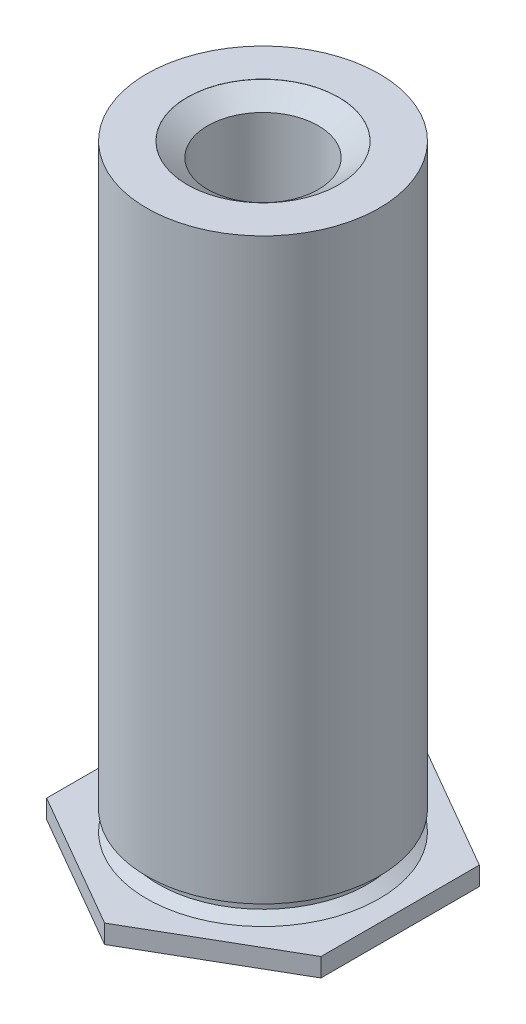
SolidWorks part; units mm, degrees
ref_plane "Plane1" through (0, 0, 0) normal (0, 0, 1) x (1, 0, 0)
ref_plane "Plane2" through (0, 0, 0) normal (0, 1, 0) x (1, 0, 0)
ref_plane "Plane3" through (0, 0, 0) normal (1, 0, 0) x (0, 0, -1)
sketch "BodySke" plane through (0, 0, 0) normal (0, 0, 1) x (1, 0, 0)
  line L0 (2.6924, 0) -> (3.683, 0)
  line L1 (3.683, 0) -> (3.683, 0.4308)
  line L2 (3.683, 0.4308) -> (2.6924, 0.4308)
  line L3 (1.2802, 14.2748) -> (1.2802, 7.4168)
  line L4 (2.6924, 0.8831) -> (2.4232, 0.8831)
  line L5 (2.4232, 0.8831) -> (2.4232, 0.5862)
  line L6 (2.6924, 0.0025) -> (2.6924, 0)
  line L7 (1.016, 13.4823) -> (3.6522, 13.4823) construction
  line L8 (2.6924, 14.2748) -> (1.2802, 14.2748)
  line L9 (0, 0) -> (0, 15.24) construction
  line L10 (2.6924, 0.0025) -> (0, 0.0025)
  line L11 (2.6924, 14.2748) -> (2.6924, 0.8831)
  line L12 (0, 7.4168) -> (1.2802, 7.4168)
  line L13 (0, 7.4168) -> (0, 0.0025)
  line L14 (1.016, 7.4168) -> (3.6522, 7.4168) construction
  line L15 (1.016, 14.2723) -> (3.6522, 14.2723) construction
  line L16 (2.6924, 0.4308) -> (2.4232, 0.5862)
  dimension "D1" = 0.0025
  dimension "E_dia" = 7.366
  dimension "D2" = 30
  dimension "C_dia" = 5.3848
  dimension "Thread_min" = 2.5603
  dimension "Clinching_ht" = 0.4308
  dimension "Advance" = 0.7925
  dimension "Length" = 14.2748
  dimension "Thread_limit" = 6.858
  dimension "Thread_depth" = 6.858
  dimension "Drill_depth" = 0.0025
  dimension "Groove_wid" = 0.4523
  dimension "Groove_dia" = 4.8463
revolve "Body" add sketch "BodySke"
revolve "EndChamfer" cut sketch "EndChamferSke" angle 360 about L0
sketch "EndChamferSke" plane through (0, 0, 0) normal (0, 0, 1) x (1, 0, 0)
  line L0 (0, -2.54) -> (0, 7.62) construction
  line L1 (0, 0) -> (0, 15.24) construction
  line L2 (1.7551, 14.2723) -> (1.7551, 14.5288)
  line L4 (1.7551, 14.2723) -> (1.7526, 14.2723)
  line L6 (1.7526, 14.2723) -> (1.2802, 13.9416)
  line L8 (1.2802, 13.9416) -> (1.2802, 14.5288)
  line L9 (1.7551, 14.5288) -> (1.2802, 14.5288)
  line L10 (2.6924, 14.2748) -> (-2.6924, 14.2748) construction
  dimension "D1" = 0.254
  dimension "Thread_nominal" = 3.5052
  dimension "D2" = 34.99
  dimension "Thread_min" = 2.5603
  dimension "Inset" = 0.0025
  dimension "B_dia" = 3.5103
revolve "TapDrill" cut sketch "TapDriSke" angle 360 about L0
sketch "TapDriSke" plane through (0, 0, 0) normal (0, 0, 1) x (1, 0, 0)
  line L0 (0, 0) -> (0, 15.24) construction
  line L1 (0, 0) -> (0, 15.24) construction
  line L2 (1.2802, 3.4544) -> (1.2802, 14.2748)
  line L3 (2.6924, 14.2748) -> (-2.6924, 14.2748) construction
  line L4 (1.2802, 3.4544) -> (0, 2.9241)
  line L5 (0, 2.9241) -> (0, 14.2748)
  line L6 (0, 14.2748) -> (1.2802, 14.2748)
  line L7 (1.2802, 7.4168) -> (1.2802, 14.2748) construction
  line L8 (0, 2.9241) -> (-1.2802, 3.4544) construction
  line L9 (-1.2802, 14.2748) -> (-1.2802, 7.4168) construction
  dimension "D1" = 135
  dimension "Depth" = 10.8204
ref_plane "Plane4" through (0, -0.5486, 0) normal (0, 1, 0) x (-1, 0, 0)
sketch "ThdSchSke" plane through (0, 0, 0) normal (0, 0, 1) x (1, 0, 0)
  line L0 (0, -5.08) -> (0, 7.62) construction
  line L1 (0, 0) -> (0, 15.24) construction
  line L2 (0, 14.2723) -> (1.7526, 14.2723) construction
  line L4 (1.7526, 14.2723) -> (1.2802, 14.6031)
  line L5 (1.7551, 14.2723) -> (-1.7551, 14.2723) construction
  line L6 (1.7526, 14.2723) -> (1.2802, 13.9415)
  line L7 (1.2802, 14.6031) -> (1.2802, 13.9415)
  dimension "Vee_angle" = 70
  dimension "Thread_nominal" = 3.5052
  dimension "Thread_min" = 2.5603
revolve "ThreadSchematic" [suppressed] cut sketch "ThdSchSke" angle 360 about L0
pattern_linear "ThdSchPat" [suppressed]
sketch "HexDieSke" plane through (0, 0.4308, 0) normal (0, 1, 0) x (-1, 0, 0)
  line L0 (0, 3.6662) -> (3.175, 1.8331)
  line L1 (3.175, 1.8331) -> (3.175, -1.8331)
  line L2 (3.175, -1.8331) -> (0, -3.6662)
  line L3 (0, -3.6662) -> (-3.175, -1.8331)
  line L4 (-3.175, -1.8331) -> (-3.175, 1.8331)
  line L5 (-3.175, 1.8331) -> (0, 3.6662)
  circle A1 centre (0, 0) radius 3.175 construction
  circle A2 centre (0, 0) radius 3.6662 construction
  circle A3 centre (0, 0) radius 3.6957
  dimension "Width_across_flats" = 6.35
  dimension "OD" = 7.3914
extrude "HexDie" cut sketch "HexDieSke" against normal blind 0.4308
equation "' \"Length@BodySke\" = 0.562"
equation "' \"C_dia@BodySke\" = 0.212"
equation "' \"Thread_depth@BodySke\" = 0.27 'always explicit"
equation "' \"Drill_depth@BodySke\" = 0.0001 'implicit, or explicit"
equation "' \"Width_across_flats@HexDieSke\" = 0.25"
equation "' \"Advance@BodySke\" = 0.0312"
equation "' \"Thread_min@BodySke\" = 0.1008"
equation "' \"Thread_nominal@ThreadCosmetic\" = 0.138"
equation "\"B_dia@EndChamferSke\" = \"Thread_nominal@ThreadCosmetic\" + 0.0002"
equation "\"E_dia@BodySke\" = \"Width_across_flats@HexDieSke\" * 1.16"
equation "\"Clinching_ht@BodySke\" = \"C_dia@BodySke\" * 0.08"
equation "\"Groove_dia@BodySke\" = \"C_dia@BodySke\" * 0.9"
equation "\"Groove_wid@BodySke\" = \"Clinching_ht@BodySke\" * 1.05"
equation "\"Thread_limit@BodySke\" = ((sgn( \"Length@BodySke\" - 0.0002 - \"Thread_depth@BodySke\" )-1)*( \"Length@BodySke\" - 0.0002 - \"Thread_depth@BodySke\" ))/-2+ \"Thread_depth@BodySke\""
equation "\"Depth@TapDriSke\" = \"Thread_limit@BodySke\" + \"Advance@BodySke\" * 5"
equation "\"Depth@TapDriSke\" = ((sgn( \"Depth@TapDriSke\" - \"Drill_depth@BodySke\" )+1)*( \"Depth@TapDriSke\" - \"Drill_depth@BodySke\" ))/2 +\"Drill_depth@BodySke\""
equation "\"Depth@HexDie\" = \"Clinching_ht@BodySke\""
equation "\"OD@HexDieSke\" =  \"Width_across_flats@HexDieSke\" * 1.16 + 0.001"
equation "\"Thread_nominal@EndChamferSke\" = \"Thread_nominal@ThreadCosmetic\""
equation "\"Thread_min@EndChamferSke\" = \"Thread_min@BodySke\""
equation "\"D2@EndChamferSke\" = \"Vee_angle@ThdSchSke\" / 2 - 0.01"
equation "\"Thread_nominal@ThdSchSke\" = \"Thread_nominal@ThreadCosmetic\""
equation "\"Thread_min@ThdSchSke\" = \"Thread_min@BodySke\""
equation "\"Num_threads@ThdSchPat\" = int(  ( \"Thread_limit@BodySke\" - \"Inset@EndChamferSke\" ) / \"Advance@BodySke\" + 0.999 )  + 1"
equation "\"Advance@ThdSchPat\" = (  \"Thread_limit@BodySke\" - \"Inset@EndChamferSke\" ) /  (\"Num_threads@ThdSchPat\" - 1) 'relax it"
